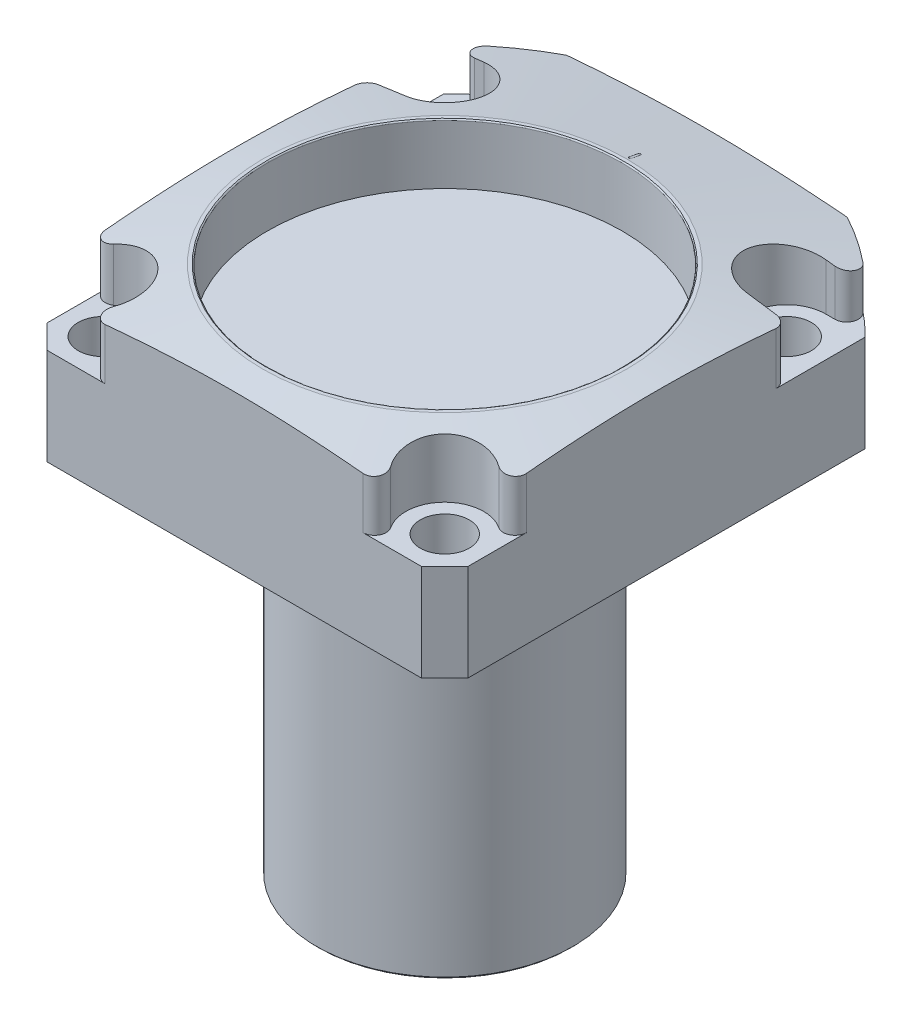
SolidWorks part; units mm, degrees
ref_plane "Front Plane" through (0, 0, 0) normal (0, 0, 1) x (1, 0, 0)
ref_plane "Top Plane" through (0, 0, 0) normal (0, 1, 0) x (1, 0, 0)
ref_plane "Right Plane" through (0, 0, 0) normal (1, 0, 0) x (0, 0, -1)
sketch "Sketch6" plane through (0, 0, 0) normal (0, 0, 1) x (1, 0, 0)
  line L0 (0, -8.9689) -> (0, 71.3762) construction
  line L1 (37.8968, 34.0614) -> (38.8747, 34.0614)
  line L2 (38.8747, 34.0614) -> (63.5, 29.7193)
  line L3 (63.5, 29.7193) -> (63.5, 0)
  line L4 (63.5, 0) -> (27.3812, 0)
  line L5 (27.3812, 0) -> (27.3812, -78.994)
  line L6 (27.3812, -78.994) -> (0, -78.994)
  line L7 (0, -78.994) -> (0, 21.2344)
  line L8 (37.8968, 34.0614) -> (37.8968, 21.2344)
  line L9 (37.8968, 21.2344) -> (0, 21.2344)
  dimension "D1" = 54.7624
  dimension "D2" = 34.0614
  dimension "D3" = 78.994
  dimension "D4" = 127
  dimension "D5" = 10
  dimension "D6" = 77.7494
  dimension "D7" = 12.827
  dimension "D8" = 75.7936
  dimension "D9" = 113.0554
revolve "Revolve3" add sketch "Sketch6" angle 360 about L0
fillet "Fillet7" radius 0.254 1 edges at (0, 34.0614, -37.8968)
sketch "Sketch7" plane through (0, 0, 0) normal (0, -1, 0) x (1, 0, 0)
  line L0 (0, 0) -> (0, -52.3237) construction
  line L1 (-39.9961, 45.0088) -> (39.9961, 45.0088)
  line L2 (-44.9961, 40.0088) -> (-44.9961, -55.9816)
  line L3 (-44.9961, -55.9816) -> (44.9961, -55.9816)
  line L4 (44.9961, 40.0088) -> (44.9961, -55.9816)
  line L5 (39.9961, 45.0088) -> (44.9961, 40.0088)
  line L6 (-44.9961, 40.0088) -> (-39.9961, 45.0088)
  point P0 (-44.9961, 45.0088)
  point P3 (44.9961, 45.0088)
  dimension "D1" = 89.9922
  dimension "D2" = 100.9904
  dimension "D3" = 45.0088
  dimension "D4" = 55.9816
  dimension "D5" = 44.9961
extrude "Cut-Extrude5" cut sketch "Sketch7" against normal through all flip side to cut
sketch "Sketch8" plane through (0, 0, 0) normal (0, -1, 0) x (1, 0, 0)
  circle A0 centre (-36.5252, 36.5252) radius 5.2451
  dimension "D1" = 10.4902
  dimension "D2" = 36.5252
  dimension "D3" = 36.5252
extrude "Cut-Extrude6" cut sketch "Sketch8" against normal through all
pattern_circular "CirPattern2" count 4 over 360 about axis through (0, 0, 0) along (0, 1, 0) of "Cut-Extrude6"
sketch "Sketch9" plane through (0, 34.0614, 0) normal (0, 1, 0) x (1, 0, 0)
  line L0 (-44.9961, -40.0088) -> (-39.9961, -45.0088) construction
  line L1 (-39.9961, -45.0088) -> (39.9961, -45.0088) construction
  line L2 (44.9961, 44.8564) -> (44.9961, 28.194)
  line L3 (-44.9961, -40.0088) -> (-39.9961, -45.0088)
  line L4 (44.9961, 28.194) -> (36.5252, 28.194)
  line L5 (36.5252, 44.8564) -> (44.9961, 44.8564)
  line L6 (-36.5252, 44.8564) -> (-44.9961, 44.8564)
  line L7 (-44.9961, 44.8063) -> (-44.9961, -40.0088) construction
  line L8 (-44.9961, 28.194) -> (-36.5252, 28.194)
  line L9 (-44.9961, 44.8564) -> (-44.9961, 28.194)
  line L10 (-39.9961, -45.0088) -> (-33.2267, -45.0088)
  line L11 (0, 0) -> (0, 26.6366) construction
  line L13 (-44.9961, -33.214) -> (-42.4162, -30.6342)
  line L14 (-30.6342, -42.4162) -> (-33.2267, -45.0088)
  line L15 (-44.9961, -33.214) -> (-44.9961, -40.0088)
  line L16 (44.9961, -33.214) -> (44.9961, -40.0088)
  line L17 (30.6342, -42.4162) -> (33.2267, -45.0088)
  line L18 (44.9961, -33.214) -> (42.4162, -30.6342)
  line L19 (39.9961, -45.0088) -> (33.2267, -45.0088)
  line L20 (44.9961, -40.0088) -> (39.9961, -45.0088)
  arc A0 (-30.6342, -42.4162) -> (-42.4162, -30.6342) centre (-36.5252, -36.5252) ccw
  arc A1 (-36.5252, 28.194) -> (-36.5252, 44.8564) centre (-36.5252, 36.5252) ccw
  arc A2 (30.6342, -42.4162) -> (42.4162, -30.6342) centre (36.5252, -36.5252) cw
  arc A3 (36.5252, 28.194) -> (36.5252, 44.8564) centre (36.5252, 36.5252) cw
  dimension "D1" = 16.6624
extrude "Cut-Extrude7" cut sketch "Sketch9" against normal offset from surface (13.4112 mm away) 20.6502
fillet "Fillet4" radius 2.4892 8 edges at (-44.9961, 26.1017, -28.194) (44.9961, 26.1017, -28.194) (44.9961, 25.8524, 33.214) (33.2267, 25.8509, 45.0088) (-33.2267, 25.8509, 45.0088) (-44.9961, 25.8524, 33.214) (44.9461, 25.1847, -44.8564) (-44.9461, 25.1847, -44.8564)
fillet "Fillet5" radius 0.4013 1 edges at (0, 0, -27.3812)
chamfer "Chamfer2" distance 0.5004 angle 45 1 edges at (0, -78.994, -27.3812)
ref_plane "Plane1" through (0, 17.018, 0) normal (0, -1, 0) x (1, 0, 0)
sketch "Sketch11" plane through (0, 17.018, 0) normal (0, -1, 0) x (1, 0, 0)
  line L0 (-18, -4.7006) -> (-18, -58.3255) construction
  line L1 (-29.9718, -55.9816) -> (29.9718, -55.9816) construction
  line L2 (-24.1849, -55.7316) -> (-23.6396, -53.1662)
  line L3 (-23.6396, -53.1662) -> (-22.9784, -52.505)
  line L10 (-18, -55.9816) -> (-28.4775, -55.9816)
  line L11 (-18, -37.0116) -> (-18, -55.9816)
  line L12 (-22.9784, -37.0116) -> (-18, -37.0116)
  line L13 (-22.9784, -52.505) -> (-22.9784, -37.0116)
  line L15 (-28.4775, -55.7316) -> (-24.1849, -55.7316)
  line L16 (-28.4775, -55.9816) -> (-28.4775, -55.7316)
  dimension "D1" = 18
  dimension "D2" = 0.25
  dimension "D3" = 18.72
  dimension "D4" = 9.9568
  dimension "D5" = 20.955
  dimension "D6" = 12
  dimension "D7" = 12.3698
  dimension "D8" = 45
  dimension "D9" = 2.5654
revolve "Cut-Revolve5" cut sketch "Sketch11" angle 360 about L0
ref_plane "Plane2" through (0, 0, -46.7614) normal (0, 0, 1) x (1, 0, 0)
sketch "Sketch13" plane through (0, 0, -46.7614) normal (0, 0, 1) x (1, 0, 0)
  line L0 (-21.4544, 17.653) -> (-21.4544, 5.3993)
  line L1 (-22.572, 2.6416) -> (-22.1293, 4.7244)
  line L2 (-22.572, 2.6416) -> (-25.9375, 2.6416)
  line L3 (-25.9375, 2.6416) -> (-25.9375, 0)
  line L4 (-27.7825, 0) -> (27.7825, 0) construction
  line L5 (-25.9375, 0) -> (-18, 0)
  line L6 (-18, 0) -> (-18, 17.653)
  line L7 (-18, 17.653) -> (-21.4544, 17.653)
  line L8 (-18, 15.2099) -> (-18, -4.3918) construction
  line L9 (-22.1293, 4.7244) -> (-21.4544, 5.3993)
  dimension "D1" = 18
  dimension "D2" = 6.9088
  dimension "D3" = 15.0114
  dimension "D4" = 2.6416
  dimension "D5" = 15.875
  dimension "D6" = 45
  dimension "D7" = 2.0828
  dimension "D8" = 12
  dimension "D9" = 9.144
revolve "Cut-Revolve6" cut sketch "Sketch13" angle 360 about L8
sketch "Sketch16" plane through (0, 0, -46.7614) normal (0, 0, 1) x (1, 0, 0)
  line L0 (-22.572, 2.6416) -> (-13.428, 2.6416) construction
  line L1 (-18, 9.3219) -> (-18, -15.1063) construction
  line L2 (-18, 5.3993) -> (-18, 13.4331) construction
  line L3 (-22.572, 0.8763) -> (-22.572, -0.889) construction
  line L4 (-24.3373, -0.889) -> (-22.572, -0.889) construction
  circle A0 centre (-24.3373, 0.8763) radius 1.7653
  dimension "D1" = 3.5306
  dimension "D3" = 1.7653
  dimension "D2" = 4.572
revolve "Revolve7" add sketch "Sketch16" angle 360 about L1
sketch "Sketch17" plane through (0, 0, 0) normal (1, 0, 0) x (0, 0, -1)
  line L0 (39.0485, 34.8025) -> (42.433, 34.2057) construction
  line L1 (55.9816, 31.045) -> (38.8747, 34.0614) construction
  line L2 (39.3671, 33.9746) -> (41.3367, 33.6273) construction
  line L3 (39.7451, 34.6797) -> (41.7147, 34.3324) construction
  line L5 (39.6062, 33.8918) -> (41.5758, 33.5445)
  line L6 (38.9572, 34.8186) -> (42.5025, 34.1934)
  arc A0 (38.9572, 34.8186) -> (39.6062, 33.8918) centre (39.7451, 34.6797) ccw
  arc A1 (41.5758, 33.5445) -> (42.5025, 34.1934) centre (41.7147, 34.3324) ccw
  dimension "D1" = 1.6
  dimension "D2" = 2
  dimension "D3" = 0.5
  dimension "D4" = 0.76
  dimension "D5" = 0.04
revolve "Cut-Revolve7" cut sketch "Sketch17" angle 360 about L6
equation "\"D3@Sketch16\"=\"D1@Sketch16\"/2"
